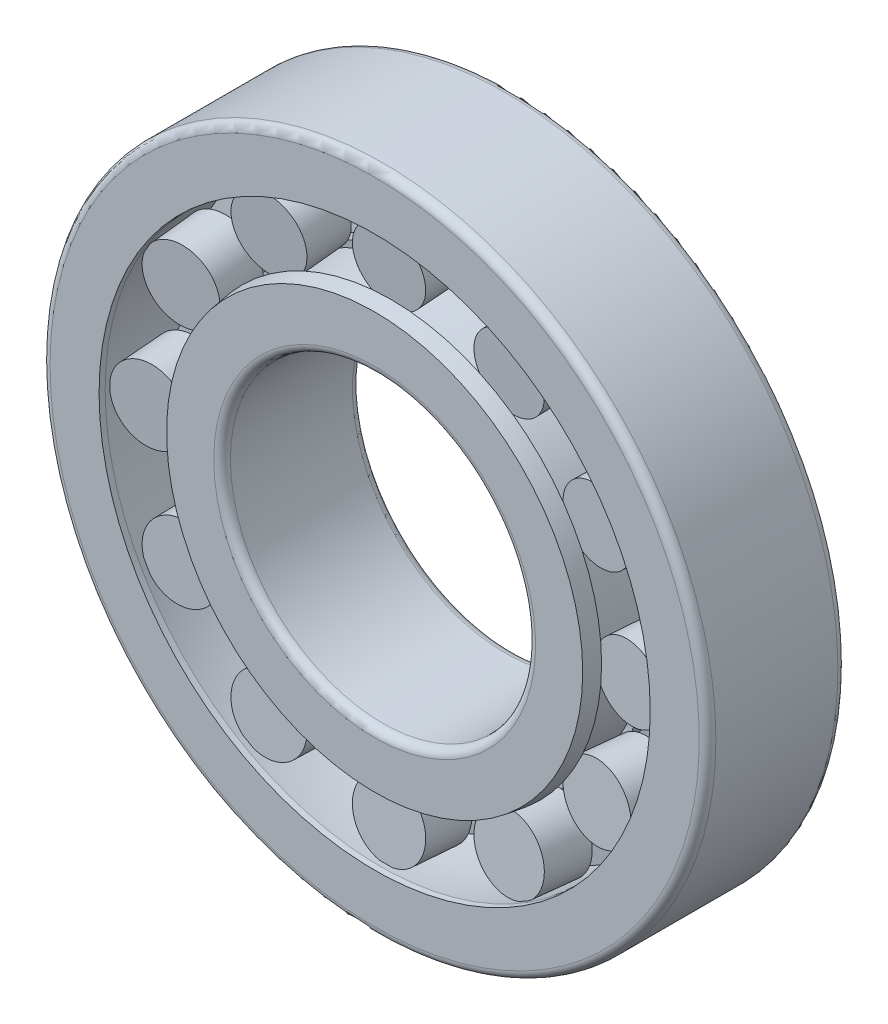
SolidWorks part; units mm, degrees
ref_plane "Front Plane" through (0, 0, 0) normal (0, 0, 1) x (1, 0, 0)
ref_plane "Top Plane" through (0, 0, 0) normal (0, 1, 0) x (1, 0, 0)
ref_plane "Right Plane" through (0, 0, 0) normal (1, 0, 0) x (0, 0, -1)
other "Configuration Table"
sketch "BaseSke" plane through (0, 0, 0) normal (1, 0, 0) x (0, 0, -1)
  line L0 (-47.2296, 0) -> (69.4868, 0) construction
  line L2 (0, 129.5214) -> (0, 100.8084) construction
  line L3 (-25, 55) -> (-25, 75) construction
  line L4 (-25, 120) -> (25, 120) construction
  line L5 (-25, 55) -> (25, 55) construction
  line L7 (25, 55) -> (25, 75) construction
  line L8 (25, 99) -> (25, 120) construction
  line L9 (-25, 99) -> (-25, 120) construction
  line L11 (0, 88.9532) -> (-25, 87) construction
  line L12 (0, 88.9532) -> (25, 87) construction
  line L13 (-25, 99) -> (-25, 75) construction
  line L14 (0, 77.098) -> (0, -86.3012) construction
  line L15 (0, 100.8084) -> (0, 77.098) construction
  line L16 (-19.8067, 86.5699) -> (-18.7801, 73.4297) construction
  line L17 (-20.8333, 99.7101) -> (-4.2173, 101.0082)
  line L18 (-20.8333, 99.7101) -> (-19.8067, 86.5699)
  line L19 (-18.7801, 73.4297) -> (-2.1641, 74.7278) construction
  line L20 (-4.2173, 101.0082) -> (-3.1907, 87.868)
  line L21 (-2.1641, 74.7278) -> (-3.1907, 87.868) construction
  line L22 (-19.8067, 86.5699) -> (-3.1907, 87.868)
  line L23 (-25, 86.1641) -> (0, 88.1173) construction
  arc A1 (-25, 99) -> (25, 99) centre (0, -72.902) cw construction
  arc A2 (25, 75) -> (-25, 75) centre (0, -72.902) ccw construction
revolve "Roller" add sketch "BaseSke" angle 360 about L23
sketch "OuterRaceSke" plane through (0, 0, 0) normal (1, 0, 0) x (0, 0, -1)
  line L0 (0, 0) -> (0, 94.5438) construction
  line L1 (-25, 120) -> (25, 120)
  line L2 (-25, 120) -> (-25, 98.9798)
  line L3 (25, 120) -> (25, 98.9798)
  line L5 (-50.3916, 0) -> (55.2197, 0) construction
  arc A0 (-25, 98.9798) -> (25, 98.9798) centre (0, -72.902) cw
  arc A2 (25, 99) -> (-25, 99) centre (0, -72.902) ccw construction
  dimension "D1" = 0.02
revolve "OuterRace" add sketch "OuterRaceSke" angle 360 about L5
sketch "InnerRaceSke" plane through (0, 0, 0) normal (1, 0, 0) x (0, 0, -1)
  line L0 (-70.8626, 0) -> (113.5527, 0) construction
  line L1 (0, 90.393) -> (0, -90.393) construction
  line L2 (-25, 55) -> (25, 55)
  line L3 (-25, 55) -> (-25, 75)
  line L4 (-19.0719, 75.8806) -> (-18.8814, 73.4418)
  line L5 (-18.8814, 73.4418) -> (-2.0659, 74.7556)
  line L7 (-2.0659, 74.7556) -> (-2.2476, 77.0812)
  line L8 (-19.8067, 86.5699) -> (-18.7801, 73.4297) construction
  line L9 (2.0659, 74.7556) -> (2.2476, 77.0812)
  line L10 (-2.1641, 74.7278) -> (-3.1907, 87.868) construction
  line L11 (-18.7801, 73.4297) -> (-2.1641, 74.7278) construction
  line L14 (18.8814, 73.4418) -> (2.0659, 74.7556)
  line L15 (19.0719, 75.8806) -> (18.8814, 73.4418)
  line L16 (25, 55) -> (25, 75)
  arc A0 (-25, 75) -> (-19.0719, 75.8806) centre (0, -72.902) cw
  arc A1 (25, 75) -> (-25, 75) centre (0, -72.902) ccw construction
  arc A2 (-2.2476, 77.0812) -> (2.2476, 77.0812) centre (0, -72.902) cw
  arc A3 (25, 75) -> (19.0719, 75.8806) centre (0, -72.902) ccw
  point P38 (0, 55)
  dimension "D2" = 0.1
  dimension "D1" = 0.02
  dimension "D3" = 0.1
revolve "InnerRace" add sketch "InnerRaceSke" angle 360 about L0
mirror "MirrorRoller" about plane through (0, 0, 0) normal (0, 0, 1) of "Roller"
fillet "Fillet1" radius 3 4 edges at (55, 0, 25) (120, 0, 25) (55, 0, -25) (120, 0, -25)
sketch "CutGrooveSke" plane through (0, 0, 0) normal (1, 0, 0) x (0, 0, -1)
  line L0 (-51.8407, 0) -> (83.8302, 0) construction
  line L1 (-12.5, -137.6) -> (-15, -137.6)
  line L2 (-12.5, -137.6) -> (-12.5, -117.6)
  line L3 (-12.5, -117.6) -> (-15, -117.6)
  line L4 (-15, -137.6) -> (-15, -117.6)
revolve "CutGroove" [suppressed] cut sketch "CutGrooveSke" angle 360 about L0
sketch "TaperSke" plane through (0, 0, 0) normal (1, 0, 0) x (0, 0, -1)
  line L0 (-25, 55) -> (25, 55)
  line L1 (25, 55) -> (25, 59.1667)
  line L2 (25, 59.1667) -> (-25, 55)
  line L7 (-41.2502, 0) -> (40.8606, 0) construction
revolve "Taper" [suppressed] cut sketch "TaperSke" angle 360 about L7
fillet "Fillet2" [suppressed] radius 3
pattern_circular "CirPatternBall" count 12 over 360 about axis through (0, 0, 0) along (0, 0, 1) of "Roller", "MirrorRoller"
sketch "SimplifiedSke" plane through (0, 0, 0) normal (1, 0, 0) x (0, 0, -1)
  line L0 (37.5911, 0) -> (-37.5911, 0) construction
  line L1 (0, 0) -> (0, 96.8272) construction
  line L2 (-18.7801, 73.4297) -> (-2.1641, 74.7278)
  line L3 (-18.7801, 73.4297) -> (-20.8333, 99.7101)
  line L4 (-20.8333, 99.7101) -> (-4.2173, 101.0082)
  line L5 (-2.1641, 74.7278) -> (-4.2173, 101.0082)
  line L7 (2.1641, 74.7278) -> (4.2173, 101.0082)
  line L8 (18.7801, 73.4297) -> (2.1641, 74.7278)
  line L9 (18.7801, 73.4297) -> (20.8333, 99.7101)
  line L10 (20.8333, 99.7101) -> (4.2173, 101.0082)
revolve "Simplified" [suppressed] add sketch "SimplifiedSke" angle 360 about L0
chamfer "Chamfer" distance 2.0833 angle 10 2 edges at (98.9798, 0, -25) (98.9798, 0, 25)
equation "\"D1@BaseSke\" = \"Bearing_Thickness@BaseSke\"*3"
equation "\"D2@BaseSke\" =  ( \"Bearing_Outside_Diameter@BaseSke\" - \"Bearing_Inside_Diameter@BaseSke\" ) /6.5"
equation "\"D3@BaseSke\" = \"D2@BaseSke\"*1.05"
equation "\"D4@BaseSke\" = \"Bearing_Thickness@BaseSke\"/3"
equation "\"D5@BaseSke\" = \"Bearing_Thickness@BaseSke\"/12"
equation "\"D6@BaseSke\" = \"Bearing_Thickness@BaseSke\"/60"
equation "\"D1@CutGrooveSke\" = \"Bearing_Outside_Diameter@BaseSke\" * 0.49"
equation "\"D2@CutGrooveSke\" = \"Bearing_Thickness@BaseSke\" *0.25"
equation "\"D3@CutGrooveSke\" = \"Bearing_Thickness@BaseSke\"/20"
equation "\"Taper@TaperSke\" = \"Bearing_Thickness@BaseSke\"/12"
equation "\"D1@Fillet2\" = \"Fillet_radius@Fillet1\""
equation "\"D1@CirPatternBall\" =  int(  ( \"Bearing_Outside_Diameter@BaseSke\" + \"Bearing_Inside_Diameter@BaseSke\" )  / 2 *  pi  /  ( \"Bearing_Outside_Diameter@BaseSke\" - \"Bearing_Inside_Diameter@BaseSke\" ) * 3 ) "
equation "\"D1@Chamfer\" = \"Bearing_Thickness@BaseSke\"/24"
